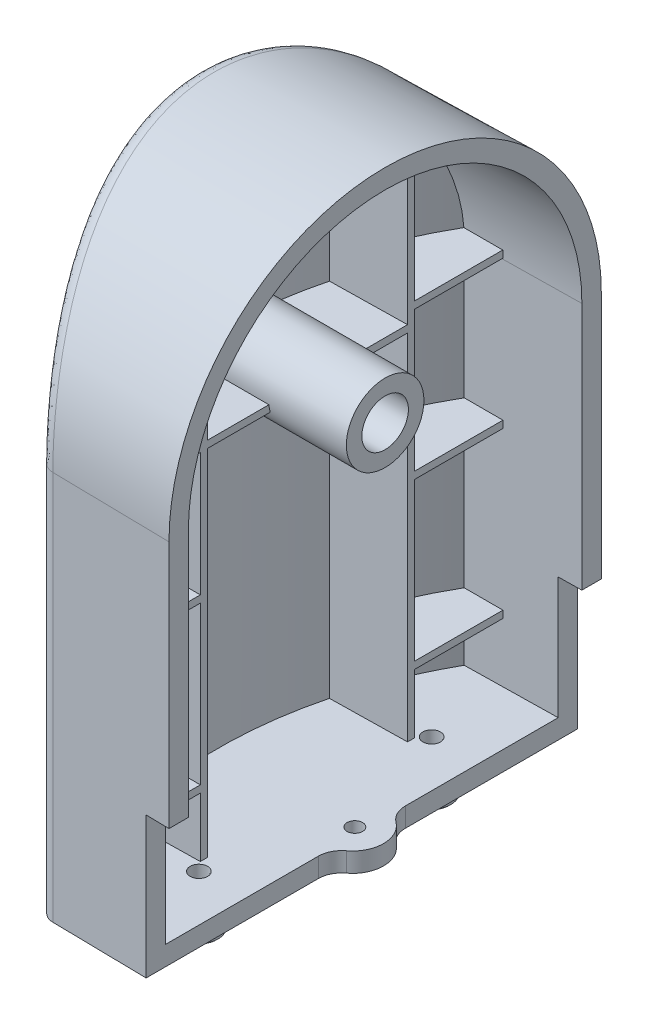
SolidWorks part; units mm, degrees
ref_plane "前视基准面" through (0, 0, 0) normal (0, 0, 1) x (1, 0, 0)
ref_plane "上视基准面" through (0, 0, 0) normal (0, 1, 0) x (1, 0, 0)
ref_plane "右视基准面" through (0, 0, 0) normal (1, 0, 0) x (0, 0, -1)
imported_body "Imported3"
imported_body "Imported4"
sketch "Sketch1" plane through (-29.5, 0, 0) normal (1, 0, 0) x (0, 0, -1)
  line L0 (-27.8, 22) -> (-5.6, 22) construction
  line L1 (0, 100.0524) -> (0, 71.56) construction
  circle A0 centre (0, 71.56) radius 5
  arc A1 (27.8524, 72.2) -> (-27.8524, 72.2) centre (0, 72.2) ccw construction
  circle A2 centre (0, 71.56) radius 3
  dimension "D1" = 10
  dimension "D2" = 49.56
  dimension "D3" = 6
extrude "Extrude1" add sketch "Sketch1" against normal up to surface (21.2543 mm away)
sketch "Sketch2" plane through (-39.5, 0, 0) normal (1, 0, 0) x (0, 0, -1)
  line L1 (-12.8896, 71.0604) -> (-3.8896, 71.0604)
  line L2 (-12.8896, 71.0604) -> (-12.8896, 70.1396)
  line L3 (-12.8896, 70.1396) -> (-3.8896, 70.1396)
  line L4 (-3.8896, 71.0604) -> (-3.8896, 70.1396)
  line L5 (-25.1774, 71.0604) -> (-13.8104, 71.0604) construction
  line L6 (-12.8896, 93.8278) -> (-12.8896, 24.5) construction
  line L7 (-13.8104, 70.1396) -> (-25.1774, 70.1396) construction
  line L8 (0, 71.56) -> (0, 76.56) construction
  line L9 (3.8896, 71.0604) -> (3.8896, 70.1396)
  line L10 (12.8896, 70.1396) -> (3.8896, 70.1396)
  line L11 (12.8896, 71.0604) -> (12.8896, 70.1396)
  line L12 (12.8896, 71.0604) -> (3.8896, 71.0604)
  circle A0 centre (0, 71.56) radius 5 construction
  dimension "D1" = 9
extrude "Extrude2" add sketch "Sketch2" against normal up to surface (11.3515 mm away)
